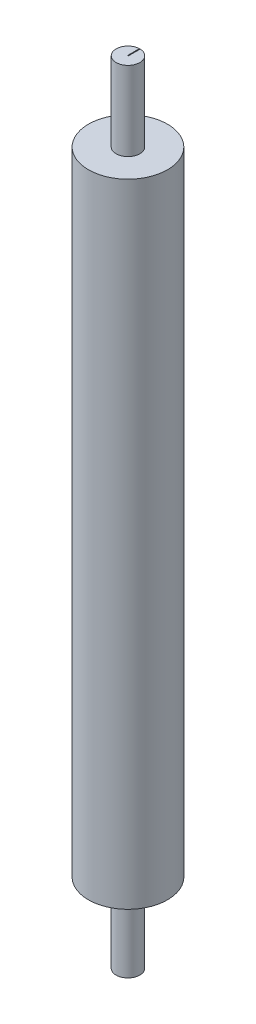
SolidWorks part; units mm, degrees
ref_plane "Alzado" through (0, 0, 0) normal (0, 0, 1) x (1, 0, 0)
ref_plane "Planta" through (0, 0, 0) normal (0, 1, 0) x (1, 0, 0)
ref_plane "Vista lateral" through (0, 0, 0) normal (1, 0, 0) x (0, 0, -1)
sketch "Croquis1" plane through (0, 0, 0) normal (0, 1, 0) x (1, 0, 0)
  circle A0 centre (0, 0) radius 25
  dimension "D1" = 50
extrude "Saliente-Extruir2" add sketch "Croquis1" along normal blind 400
sketch "Croquis3" plane through (0, 0, 0) normal (0, 1, 0) x (1, 0, 0)
  circle A0 centre (0, 0) radius 7.5
  dimension "D1" = 15
extrude "Saliente-Extruir3" add sketch "Croquis3" against normal blind 40 contours A0
sketch "Croquis4" plane through (0, 0, 0) normal (0, 1, 0) x (1, 0, 0)
  circle A0 centre (0, 0) radius 7.5
  dimension "D1" = 15
extrude "Saliente-Extruir4" add sketch "Croquis4" against normal blind 50
sketch "Croquis5" plane through (0, 400, 0) normal (0, 1, 0) x (1, 0, 0)
  circle A0 centre (0, 0) radius 7.5
  dimension "D1" = 15
extrude "Saliente-Extruir6" add sketch "Croquis5" along normal blind 50 contours A0
sketch "Croquis6" plane through (0, 450, 0) normal (0, 1, 0) x (1, 0, 0)
  line L0 (0, 0) -> (0, 7.5)
  circle A0 centre (0, 0) radius 7.5 construction
extrude "Cortar-Extruir-Lámina1" cut sketch "Croquis6" against normal blind 0.5 thin
